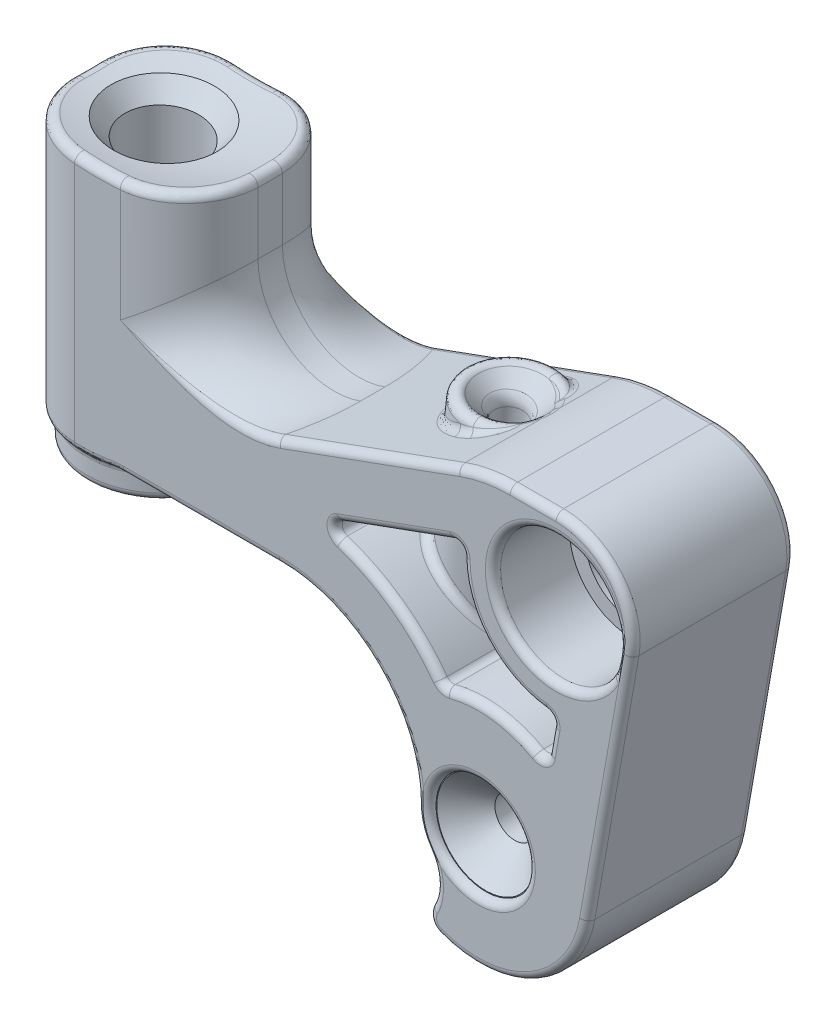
SolidWorks part; units mm, degrees
other "<Mk8 Extruder Arm dual right>-<Chamfer2>"
ref_plane "Front Plane" through (0, 0, 0) normal (0, 0, 1) x (1, 0, 0)
ref_plane "Top Plane" through (0, 0, 0) normal (0, 1, 0) x (1, 0, 0)
ref_plane "Right Plane" through (0, 0, 0) normal (1, 0, 0) x (0, 0, -1)
mirrored part "Mk8 Extruder Arm dual right_Mirrored"
